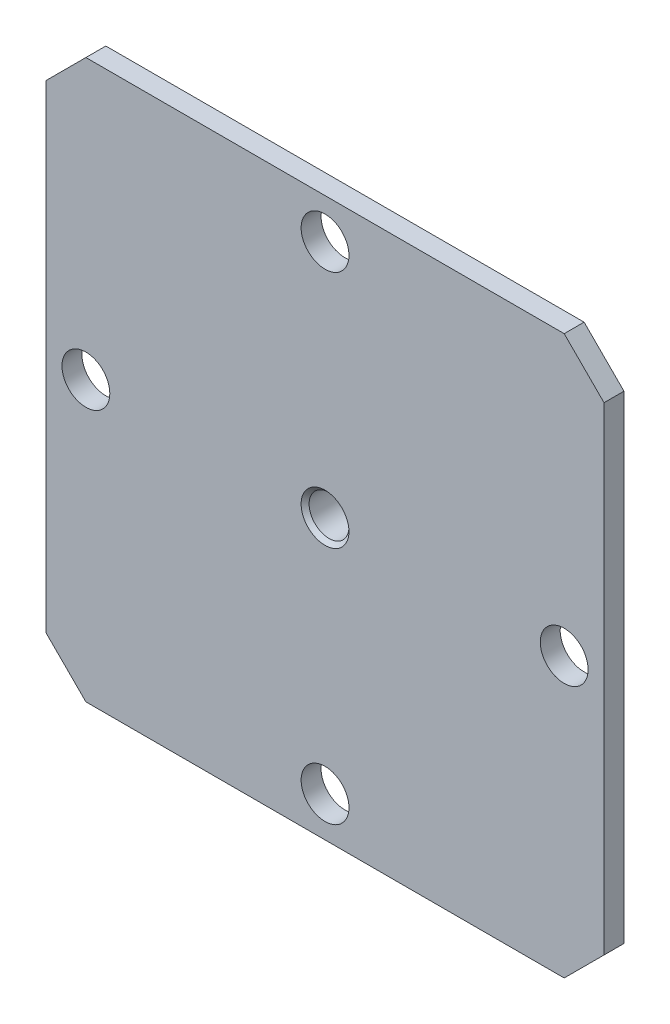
SolidWorks part; units mm, degrees
ref_plane "Спереди" through (0, 0, 0) normal (0, 0, 1) x (1, 0, 0)
ref_plane "Сверху" through (0, 0, 0) normal (0, 1, 0) x (1, 0, 0)
ref_plane "Справа" through (0, 0, 0) normal (1, 0, 0) x (0, 0, -1)
sketch "Sketch1" plane through (0, 0, 0) normal (0, 0, 1) x (1, 0, 0)
  line L4 (-70, -70) -> (-70, 70)
  line L5 (-70, 70) -> (70, 70)
  line L6 (70, -70) -> (70, 70)
  line L7 (-70, -70) -> (70, -70)
  line L8 (0, 104.1724) -> (0, -99.0659) construction
  line L9 (106.7257, 0) -> (-111.8321, 0) construction
  dimension "D1" = 140
  dimension "D2" = 140
extrude "Extrude1" add sketch "Sketch1" along normal blind 5
sketch "Sketch2" plane through (0, 0, 5) normal (0, 0, 1) x (1, 0, 0)
  line L0 (0, 79.029) -> (0, -82.6512) construction
  line L1 (89.5662, 0) -> (-89.2369, 0) construction
  circle A0 centre (0, 60) radius 6
  circle A1 centre (60, 0) radius 6
  circle A2 centre (0, -60) radius 6
  circle A3 centre (-60, 0) radius 6
  dimension "D1" = 120
  dimension "D2" = 12
extrude "Cut-Extrude1" cut sketch "Sketch2" against normal up to next
chamfer "Chamfer1" distance 10 angle 45 4 edges at (-70, 70, 2.5) (70, 70, 2.5) (70, -70, 2.5) (-70, -70, 2.5)
sketch "Sketch3" plane through (0, 0, 5) normal (0, 0, 1) x (1, 0, 0)
  line L0 (0, 60) -> (0, -60) construction
  line L1 (60, 0) -> (-60, 0) construction
  line L2 (-10, -10) -> (-10, 10)
  line L3 (-10, 10) -> (10, 10)
  line L4 (10, -10) -> (10, 10)
  line L5 (-10, -10) -> (10, -10)
  dimension "D1" = 20
extrude "Extrude2" add sketch "Sketch3" against normal blind 7 from surface at -5
sketch "Sketch4" plane through (0, 0, 5) normal (0, 0, 1) x (1, 0, 0)
  circle A0 centre (0, 0) radius 5
  dimension "D1" = 10
extrude "Cut-Extrude2" cut sketch "Sketch4" against normal up to next
chamfer "Chamfer2" distance 1 angle 45 1 edges at (5, 0, 5)
